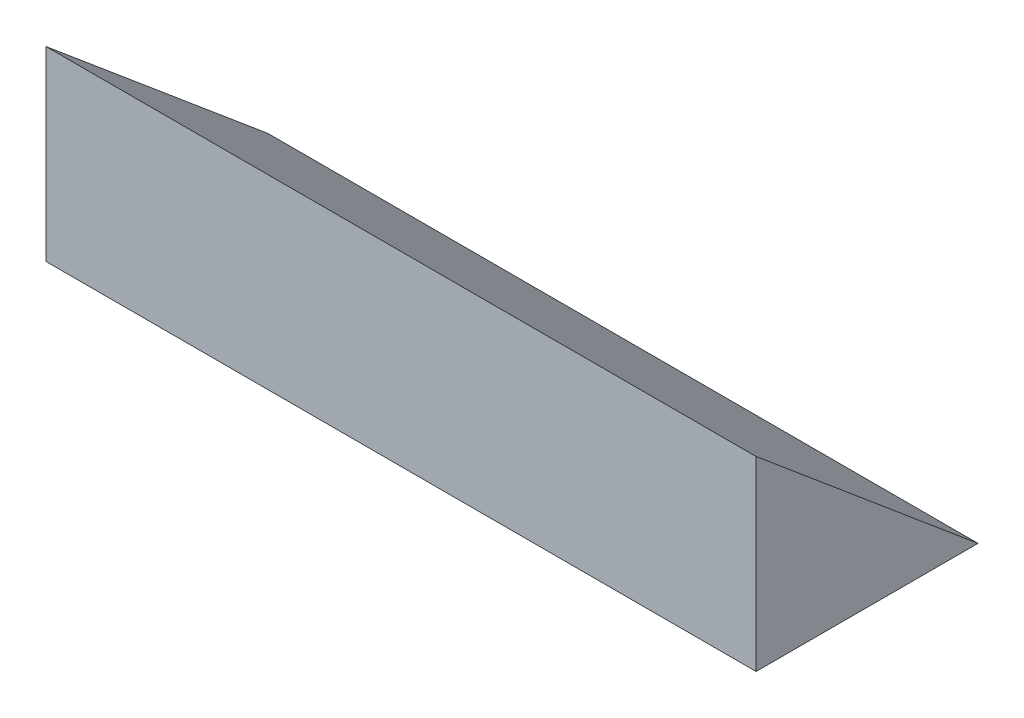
SolidWorks part; units mm, degrees
ref_plane "Plan de face" through (0, 0, 0) normal (0, 0, 1) x (1, 0, 0)
ref_plane "Plan de dessus" through (0, 0, 0) normal (0, 1, 0) x (1, 0, 0)
ref_plane "Plan de droite" through (0, 0, 0) normal (1, 0, 0) x (0, 0, -1)
sketch "Esquisse1" plane through (0, 0, 0) normal (1, 0, 0) x (0, 0, -1)
  line L0 (0, 0) -> (500, 0)
  line L1 (500, 0) -> (0, 419.5498)
  line L2 (0, 0) -> (0, 419.5498)
  dimension "D1" = 40
  dimension "D2" = 500
extrude "Boss.-Extru.1" add sketch "Esquisse1" along normal blind 1600
sketch "Esquisse2" plane through (0, 0, 0) normal (0, -1, 0) x (1, 0, 0)
  line L0 (800, -500) -> (800, 0) construction
  line L1 (1600, -500) -> (0, -500) construction
  line L2 (1600, 0) -> (0, 0) construction
  line L3 (800, -250) -> (258.9561, -250) construction
  circle A0 centre (550, -250) radius 5
  circle A1 centre (1050, -250) radius 5
  dimension "D1" = 250
extrude "Enlèv. mat.-Extru.1" cut sketch "Esquisse2" against normal blind 10
